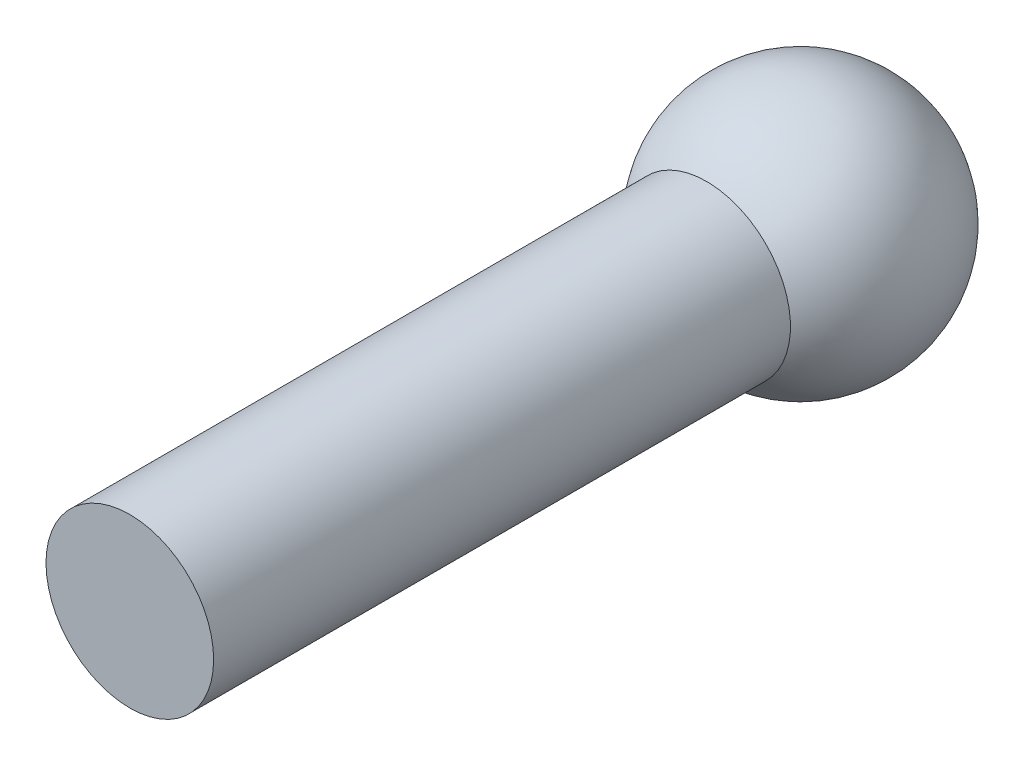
SolidWorks part; units mm, degrees
ref_plane "Plan de face" through (0, 0, 0) normal (0, 0, 1) x (1, 0, 0)
ref_plane "Plan de dessus" through (0, 0, 0) normal (0, 1, 0) x (1, 0, 0)
ref_plane "Plan de droite" through (0, 0, 0) normal (1, 0, 0) x (0, 0, -1)
sketch "Esquisse1" plane through (0, 0, 0) normal (0, 0, 1) x (1, 0, 0)
  circle A0 centre (0, 0) radius 0.5
extrude "Boss.-Extru.1" add sketch "Esquisse1" along normal blind 4
sketch "Esquisse2" plane through (0, 0, 0) normal (0, 0, -1) x (-1, 0, 0)
  line L0 (0, 0.75) -> (0, -0.75) construction
  line L1 (0, 0.75) -> (0, -0.75)
  arc A0 (0, 0.75) -> (0, -0.75) centre (0, 0) cw
  dimension "D1" = 1.5
  dimension "D2" = 0.75
revolve "Révolution1" add sketch "Esquisse2" angle 360 about L0
ref_point "Point1"
